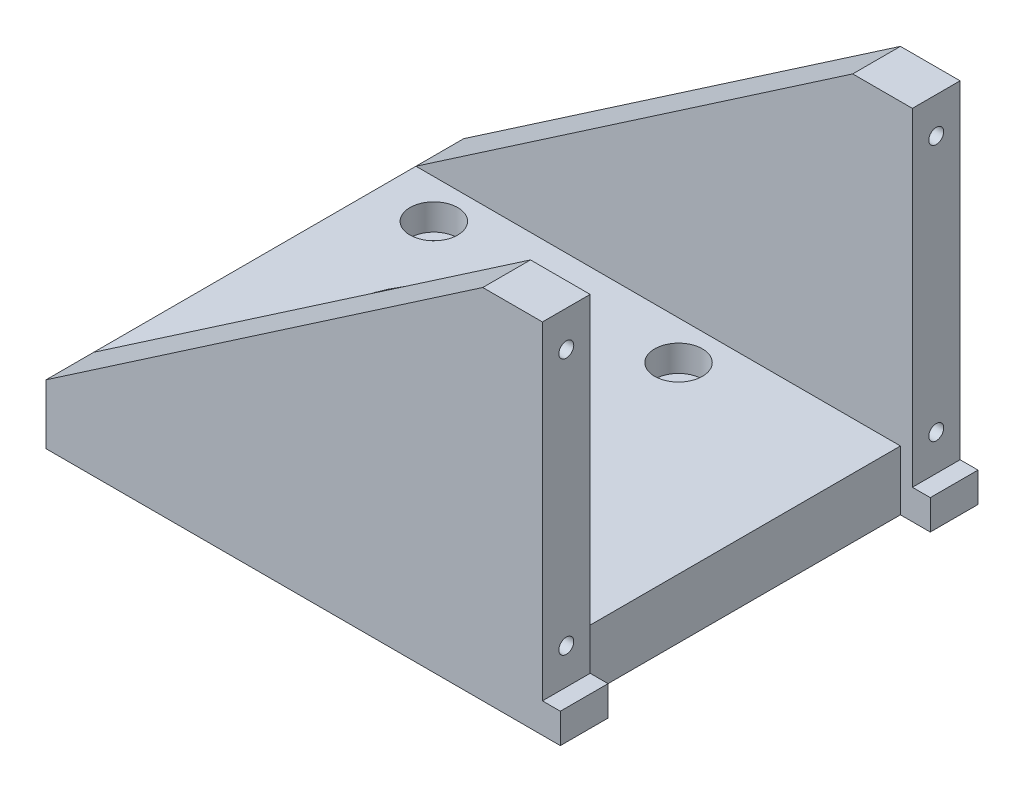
SolidWorks part; units mm, degrees
ref_plane "Plan1" through (0, 0, 0) normal (0, 0, 1) x (1, 0, 0)
ref_plane "Plan2" through (0, 0, 0) normal (0, 1, 0) x (1, 0, 0)
ref_plane "Plan3" through (0, 0, 0) normal (1, 0, 0) x (0, 0, -1)
sketch "Esquisse1" plane through (0, 0, 0) normal (0, 0, 1) x (1, 0, 0)
  line L0 (-30, 10) -> (-30, 0)
  line L1 (-30, 0) -> (56.2, 0)
  line L2 (53.2, 5) -> (53.2, 60)
  line L3 (53.2, 60) -> (43.2, 60)
  line L4 (43.2, 60) -> (-30, 10)
  line L5 (50, 0) -> (-50, 0) construction
  line L6 (0, -50) -> (0, 50) construction
  line L7 (53.2, 5) -> (56.2, 5)
  line L8 (56.2, 5) -> (56.2, 0)
  dimension "D1" = 53.2
  dimension "D2" = 30
  dimension "D3" = 10
  dimension "D4" = 60
  dimension "D5" = 10
  dimension "D6" = 3
  dimension "D7" = 5
extrude "Boss.-Extru.1" add sketch "Esquisse1" along normal mid plane 70
sketch "Esquisse2" plane through (0, 0, 0) normal (0, 0, 1) x (1, 0, 0)
  line L0 (0, 90.0185) -> (0, -6.1913) construction
  line L1 (0, -50) -> (0, 50) construction
  line L2 (0, 0) -> (0, 80)
  line L3 (0, 80) -> (16, 80)
  line L4 (16, 80) -> (16, 2.5)
  line L5 (16, 2.5) -> (24.05, 2.5)
  line L6 (24.05, 2.5) -> (24.05, 0)
  line L7 (24.05, 0) -> (0, 0)
  line L8 (-30, 0) -> (56.2, 0) construction
  dimension "D1" = 48.1
  dimension "D2" = 2.5
  dimension "D3" = 32
  dimension "D4" = 80
revolve "Enlèvement de matière-Révolution1" cut sketch "Esquisse2" angle 360 about L0
sketch "Esquisse3" plane through (0, 0, 0) normal (1, 0, 0) x (0, 0, -1)
  line L0 (0, 82.3263) -> (0, -18.5387) construction
  line L1 (0, 50) -> (0, -50) construction
  line L2 (-35, 60) -> (35, 60) construction
  line L3 (-27, 60) -> (27, 60)
  line L4 (-27, 60) -> (-27, 10)
  line L5 (-27, 10) -> (27, 10)
  line L6 (27, 60) -> (27, 10)
  line L7 (-35, 0) -> (35, 0) construction
  line L8 (35, 5) -> (35, 60) construction
  dimension "D1" = 10
  dimension "D2" = 8
extrude "Enlèv. mat.-Extru.1" cut sketch "Esquisse3" against normal through all and the other way through all
sketch "Esquisse4" plane through (53.2, 0, 0) normal (1, 0, 0) x (0, 0, -1)
  line L0 (-27, 10) -> (-27, 60) construction
  line L1 (-27, 10) -> (27, 10)
  line L2 (-27, 10) -> (-27, 0)
  line L3 (-27, 0) -> (27, 0)
  line L4 (27, 10) -> (27, 0)
  line L5 (27, 60) -> (27, 10) construction
  line L6 (27, 10) -> (-27, 10) construction
  line L8 (-35, 0) -> (35, 0) construction
extrude "Enlèv. mat.-Extru.2" cut sketch "Esquisse4" against normal blind 2 and the other way through all
hole_wizard "Chambrage pour vis à tête hexagonale M41" positions "Esquisse6" profile "Esquisse5" counterbore size "M4" standard "ISO"
sketch "Esquisse6" plane through (0, 10, 0) normal (0, 1, 0) x (1, 0, 0)
  line L0 (0, 0) -> (20.5061, 20.5061)
  line L2 (0, -50) -> (0, 50) construction
  circle A1 centre (0, 0) radius 29
  point P0 (20.5061, 20.5061)
  dimension "D1" = 45
  dimension "D2" = 58
sketch "Esquisse5" plane through (20.5061, 10, -20.5061) normal (1, 0, 0) x (0, 0, 1)
  line L0 (0, 0) -> (0, 10)
  line L1 (0, 10) -> (2.25, 10)
  line L3 (2.25, 10) -> (2.25, 4.4)
  line L4 (2.25, 4.4) -> (4, 4.4)
  line L5 (4, 4.4) -> (4, 0)
  line L7 (4, 0) -> (0, 0)
  line L11 (0, -6.35) -> (0, 107.95) construction
  dimension "Diamètre du perçage jusqu'au prochain" = 4.5
  dimension "Profondeur du perçage jusqu'au prochain" = 10
  dimension "Diamètre du chambrage" = 8
  dimension "Profondeur du chambrage" = 4.4
pattern_circular "Répétition circulaire1" count 4 over 360 about axis through (0, 0, 0) along (0, 1, 0) of "Chambrage pour vis à tête hexagonale M41"
hole_wizard "Trou taraudé M31" positions "Esquisse8" profile "Esquisse7" tap size "M3" standard "ISO"
sketch "Esquisse8" plane through (53.2, 0, 0) normal (1, 0, 0) x (0, 0, -1)
  line L0 (0, 58.9297) -> (0, -3.9904) construction
  line L2 (0, 50) -> (0, -50) construction
  line L3 (-35, 5) -> (-35, 60) construction
  line L4 (-35, 5) -> (-27, 5) construction
  line L5 (-35, 60) -> (-27, 60) construction
  point P0 (-31, 11)
  point P2 (-31, 54)
  point P12 (31, 54)
  point P13 (31, 11)
  dimension "D1" = 4
  dimension "D2" = 62
  dimension "D3" = 6
  dimension "D4" = 6
  dimension "D5" = 43
sketch "Esquisse7" plane through (53.2, 11, 31) normal (0, 1, 0) x (0, 0, -1)
  line L0 (0, 0) -> (0, 11.7511)
  line L1 (0, 11.7511) -> (1.25, 11)
  line L2 (1.25, 11) -> (1.25, 0)
  line L5 (1.25, 0) -> (0, 0)
  line L10 (0, 11.7511) -> (-1.25, 11) construction
  line L11 (0, -6.35) -> (0, 107.95) construction
  dimension "Diamètre du trou pour taraudage" = 2.5
  dimension "Profondeur du trou pour taraudage" = 11
  dimension "Angle de pointe" = 118
